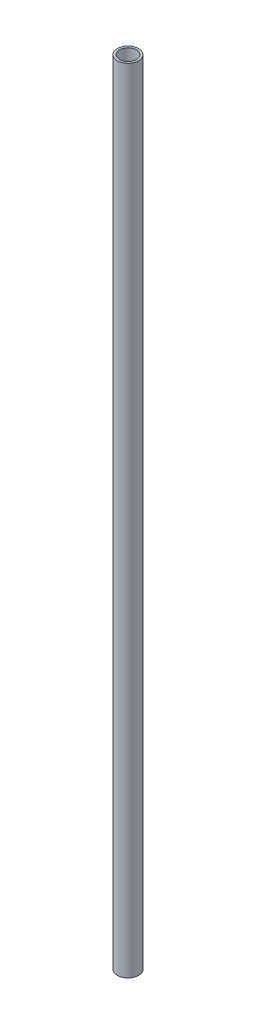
SolidWorks part; units mm, degrees
ref_plane "Front" through (0, 0, 0) normal (0, 0, 1) x (1, 0, 0)
ref_plane "Top" through (0, 0, 0) normal (0, 1, 0) x (1, 0, 0)
ref_plane "Right" through (0, 0, 0) normal (1, 0, 0) x (0, 0, -1)
sketch "草图1" plane through (0, 0, 0) normal (0, 1, 0) x (1, 0, 0)
  circle A0 centre (0, 0) radius 2.5
  circle A1 centre (0, 0) radius 2
  dimension "D1" = 5
  dimension "D2" = 4
extrude "凸台-拉伸1" add sketch "草图1" along normal blind 187
